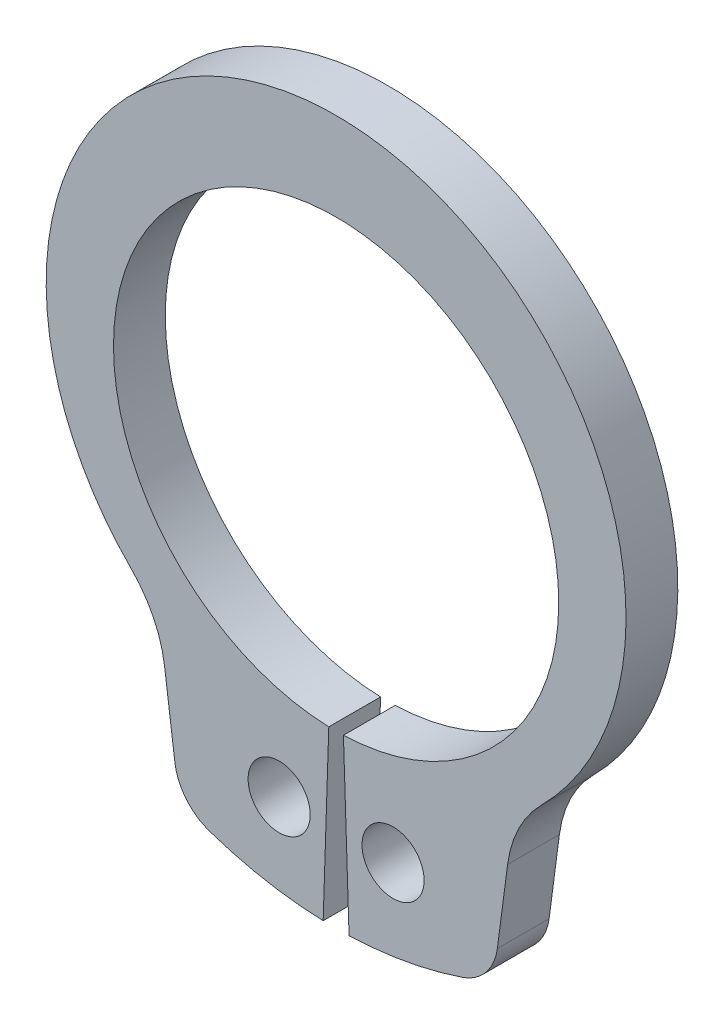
SolidWorks part; units mm, degrees
ref_plane "Plane1" through (0, 0, 0) normal (0, 0, 1) x (1, 0, 0)
ref_plane "Plane2" through (0, 0, 0) normal (0, 1, 0) x (1, 0, 0)
ref_plane "Plane3" through (0, 0, 0) normal (1, 0, 0) x (0, 0, -1)
sketch "Clipboard" plane through (0, 0, 0) normal (0, 0, 1) x (1, 0, 0)
  line L0 (0, 0) -> (1.7, 0)
  line L1 (0, 0) -> (0, 1.02)
  line L2 (0, 0) -> (0, -3.3)
  circle A0 centre (0, 0) radius 0.6
  circle A1 centre (0, 0) radius 4.5
  dimension "HoleDia" = 1.2
  dimension "ShaftDia" = 9
  dimension "LargeSection" = 1.7
  dimension "SmallSection" = 1.02
  dimension "LugSection" = 3.3
sketch "BodySke" plane through (0, 0, 0) normal (0, 0, 1) x (1, 0, 0)
  line L0 (-1.5431, 0) -> (1.5431, 0) construction
  line L1 (0, 0) -> (0, 6) construction
  line L2 (0.1414, -4.2977) -> (0.25, -7.5959)
  line L3 (-0.1414, -4.2977) -> (-0.25, -7.5959)
  line L4 (0, 0) -> (5.571, -5.1695) construction
  line L5 (0, 0) -> (-5.571, -5.1695) construction
  line L7 (3.3127, -4.8722) -> (3.1142, -6.3798)
  line L8 (-3.3127, -4.8722) -> (-3.1142, -6.3798)
  circle A0 centre (0, 0) radius 4.3 construction
  arc A1 (0.1414, -4.2977) -> (-0.1414, -4.2977) centre (0, 0) ccw
  arc A2 (3.8997, -3.6187) -> (-3.8997, -3.6187) centre (0, 0.4001) ccw construction
  arc A3 (0.25, -7.5959) -> (2.4444, -7.1962) centre (0, 0) ccw
  arc A4 (3.9602, -3.5591) -> (3.3127, -4.8722) centre (5.571, -5.1695) ccw
  arc A5 (-3.3127, -4.8722) -> (-3.9602, -3.5591) centre (-5.571, -5.1695) ccw
  arc A6 (-2.4444, -7.1962) -> (-0.25, -7.5959) centre (0, 0) ccw
  arc A7 (3.9602, -3.5591) -> (-3.9602, -3.5591) centre (0, 0.4001) ccw
  arc A8 (-3.2853, -5.0803) -> (3.2853, -5.0803) centre (0, 0) ccw construction
  circle A9 centre (1.1, -5.9492) radius 0.6
  circle A10 centre (-1.1, -5.9492) radius 0.6
  arc A11 (3.1142, -6.3798) -> (2.4444, -7.1962) centre (2.1228, -6.2493) cw
  arc A12 (-3.1142, -6.3798) -> (-2.4444, -7.1962) centre (-2.1228, -6.2493) ccw
  point P28 (3.0369, -6.9669)
  point P31 (-3.0369, -6.9669)
  dimension "GrooveDia" = 8.6
  dimension "D3" = 1
  dimension "LugRad" = 7.6
  dimension "HoleOffsetRad" = 6.05
  dimension "HoleDia" = 1.2
  dimension "D2" = 15
  dimension "LargeRad" = 6
  dimension "SmallRad" = 5.32
  dimension "Gap" = 0.5
  dimension "SmallAngle" = 94.281
  dimension "HoleSpacing" = 2.2
extrude "Body" add sketch "BodySke" against normal blind 1
sketch "NotSke" plane through (0, 0, 0) normal (0, 0, 1) x (1, 0, 0)
  line L0 (1.1, -5.3492) -> (1.1, -6.5492)
  line L1 (1.1, -6.5492) -> (-1.1, -6.5492)
  line L2 (-1.1, -6.5492) -> (-1.1, -5.3492)
  line L3 (-1.1, -5.3492) -> (1.1, -5.3492)
  circle A0 centre (1.1, -5.9492) radius 0.6 construction
  circle A1 centre (-1.1, -5.9492) radius 0.6 construction
extrude "Notch" [suppressed] cut sketch "NotSke" against normal through all
sketch "UnlSke" plane through (0, 0, 0) normal (0, 0, 1) x (1, 0, 0)
  line L0 (2.4444, -3.5376) -> (2.4444, -7.1962)
  line L1 (-2.4444, -3.5376) -> (-2.4444, -7.1962)
  arc A0 (2.4444, -3.5376) -> (-2.4444, -3.5376) centre (0, 0) ccw
  arc A1 (2.4444, -7.1962) -> (-2.4444, -7.1962) centre (0, 0) ccw
  arc A4 (-2.4444, -7.1962) -> (-0.25, -7.5959) centre (0, 0) ccw construction
  arc A5 (0.1414, -4.2977) -> (-0.1414, -4.2977) centre (0, 0) ccw construction
extrude "Unlug" [suppressed] add sketch "UnlSke" against normal through all
equation "' \"ShaftDia@Clipboard\" = 3"
equation "' \"Thickness@Body\" = 0.4"
equation "' \"GrooveDia@BodySke\" = 2.8"
equation "' \"LugSection@Clipboard\" = 1.9"
equation "' \"LargeSection@Clipboard\" = 0.8"
equation "' \"HoleDia@Clipboard\" = 0.8"
equation "' \"ShaftDia@Clipboard\" = 9"
equation "' \"Thickness@Body\" = 1"
equation "' \"GrooveDia@BodySke\" = 8.6"
equation "' \"LugSection@Clipboard\" = 3.3"
equation "' \"LargeSection@Clipboard\" = 1.7"
equation "' \"HoleDia@Clipboard\" = 1.2"
equation "\"SmallSection@Clipboard\" =  \"LargeSection@Clipboard\" * 0.6"
equation "\"Gap@BodySke\" =  \"Thickness@Body\" / 2"
equation "\"LargeRad@BodySke\" =  \"GrooveDia@BodySke\" / 2 +  \"LargeSection@Clipboard\""
equation "\"SmallRad@BodySke\" =  \"GrooveDia@BodySke\" / 2 +  \"SmallSection@Clipboard\""
equation "\"LugRad@BodySke\" = \"GrooveDia@BodySke\" / 2 + \"LugSection@Clipboard\""
equation "\"HoleOffsetRad@BodySke\" = (  \"ShaftDia@Clipboard\" / 2 + \"LugRad@BodySke\" ) / 2"
equation "\"HoleSpacing@BodySke\" = \"Gap@BodySke\"  * 2 +  \"HoleDia@Clipboard\""
equation "\"HoleDia@BodySke\" =  \"HoleDia@Clipboard\""
equation "\"SmallAngle@BodySke\" = atn(\"HoleSpacing@BodySke\" / 2 / sqr(\"HoleOffsetRad@BodySke\"  * \"HoleOffsetRad@BodySke\" - (\"HoleSpacing@BodySke\" / 2) * (\"HoleSpacing@BodySke\" / 2) ))  * 9 * ( 180 / 3.141593)"
